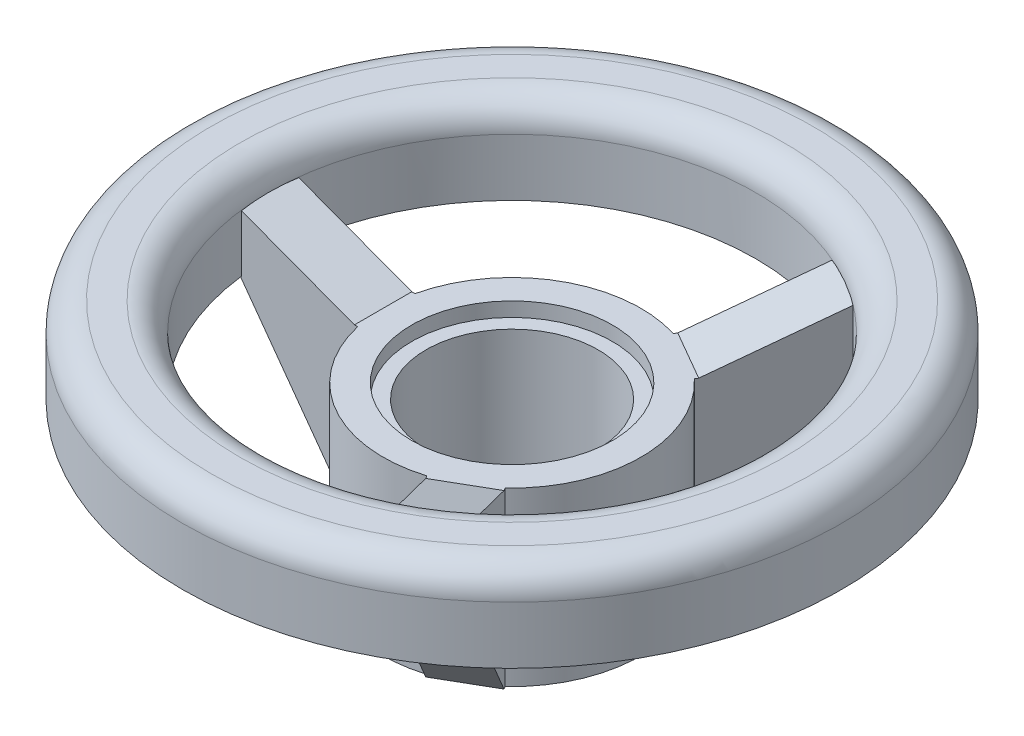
SolidWorks part; units mm, degrees
ref_plane "Face" through (0, 0, 0) normal (0, 0, 1) x (1, 0, 0)
ref_plane "Dessus" through (0, 0, 0) normal (0, 1, 0) x (1, 0, 0)
ref_plane "Droite" through (0, 0, 0) normal (1, 0, 0) x (0, 0, -1)
sketch "Esquisse1" plane through (0, 0, 0) normal (0, 0, 1) x (1, 0, 0)
  line L0 (0, 21.7519) -> (0, -13.8762) construction
  line L1 (-1.75, 0) -> (-1.75, -0.25)
  line L2 (-1.75, -0.25) -> (-1.5, -0.25)
  line L3 (-1.5, -0.25) -> (-1.5, -3)
  line L4 (-1.5, -3) -> (-2.25, -3)
  line L5 (-2.25, -3) -> (-2.25, 0)
  line L6 (-2.25, 0) -> (-1.75, 0)
  line L8 (-5.75, 0.75) -> (-4.25, 0.75)
  line L9 (-5.75, 0.75) -> (-5.75, -0.25)
  line L10 (-5.75, -0.25) -> (-4.25, -0.25)
  line L11 (-4.25, 0.75) -> (-4.25, -0.25)
  dimension "D1" = 0.25
  dimension "D2" = 0.25
  dimension "D3" = 0.5
  dimension "D4" = 3
  dimension "D5" = 2.75
  dimension "D6" = 1
  dimension "D7" = 1.5
  dimension "D8" = 0.75
  dimension "D9" = 2
revolve "Révolution1" add sketch "Esquisse1" angle 360 about L0
sketch "Esquisse4" plane through (0, 0, 0) normal (0, 0, 1) x (1, 0, 0)
  line L0 (-1.75, 0) -> (-2.25, 0)
  line L7 (-2.25, 0) -> (-4.25, 0.75)
  line L11 (-4.25, 0.75) -> (-4.7938, 0.75)
  line L12 (5.75, 0.75) -> (-5.75, 0.75) construction
  line L13 (-4.7938, 0.75) -> (-4.7938, -0.25)
  line L14 (-5.75, -0.25) -> (5.75, -0.25) construction
  line L15 (-4.7938, -0.25) -> (-4.25, -0.25)
  line L17 (-4.25, -0.25) -> (-2.25, -3)
  line L19 (-2.25, -3) -> (-1.75, -3)
  line L20 (-1.75, -3) -> (-1.75, 0)
extrude "Extrusion3" add sketch "Esquisse4" along normal mid plane 1
pattern_circular "Répétition circulaire1" count 3 every 120 about axis through (0, 0, 0) along (0, 1, 0) of "Extrusion3"
sketch "Esquisse5" plane through (0, 0.75, 0) normal (0, 1, 0) x (-1, 0, 0)
  circle A0 centre (0, 0) radius 4.25
  circle A1 centre (0, 0) radius 5.75
extrude "Extrusion4" add sketch "Esquisse5" along normal blind 0.5
fillet "Congé4" radius 0.5 2 edges at (0, 1.25, 5.75) (0, 1.25, 4.25)
